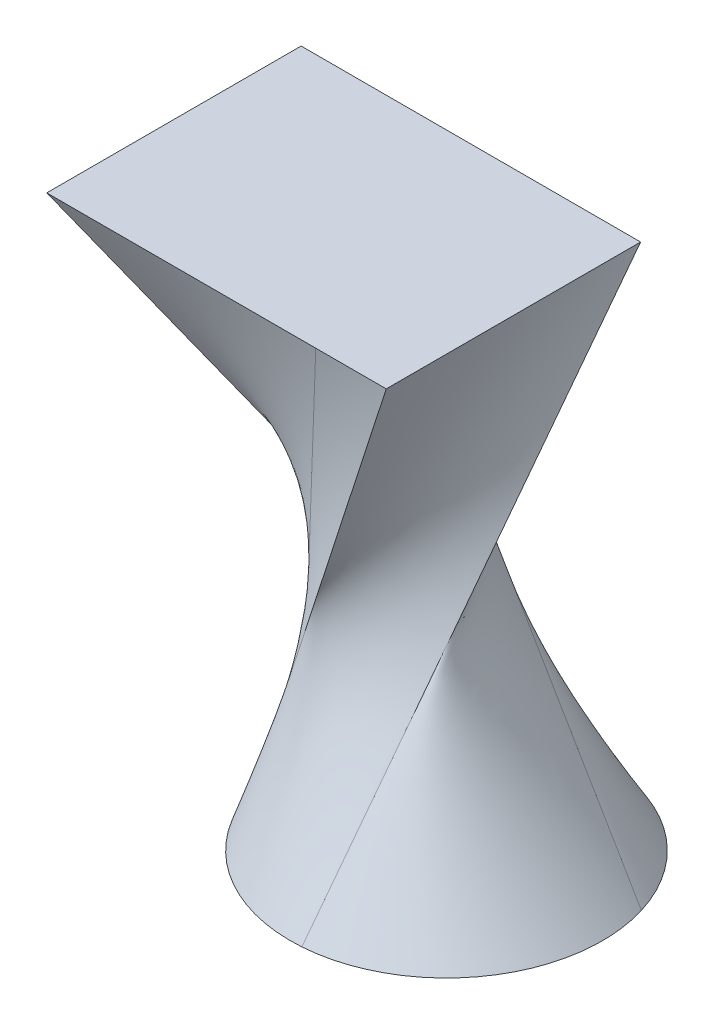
SolidWorks part; units mm, degrees
ref_plane "Front Plane" through (0, 0, 0) normal (0, 0, 1) x (1, 0, 0)
ref_plane "Top Plane" through (0, 0, 0) normal (0, 1, 0) x (1, 0, 0)
ref_plane "Right Plane" through (0, 0, 0) normal (1, 0, 0) x (0, 0, -1)
sketch "Sketch1" plane through (0, 0, 0) normal (0, 1, 0) x (1, 0, 0)
  circle A0 centre (0, 0) radius 61.2052
ref_plane "Plane1" through (0, 177.8, 0) normal (0, 1, 0) x (1, 0, 0)
sketch "Sketch2" plane through (0, 177.8, 0) normal (0, 1, 0) x (1, 0, 0)
  line L1 (-123.8238, 66.8495) -> (9.2583, 66.8495)
  line L2 (-123.8238, 66.8495) -> (-123.8238, -32.8586)
  line L3 (-123.8238, -32.8586) -> (9.2583, -32.8586)
  line L4 (9.2583, 66.8495) -> (9.2583, -32.8586)
other "Boundary1"
